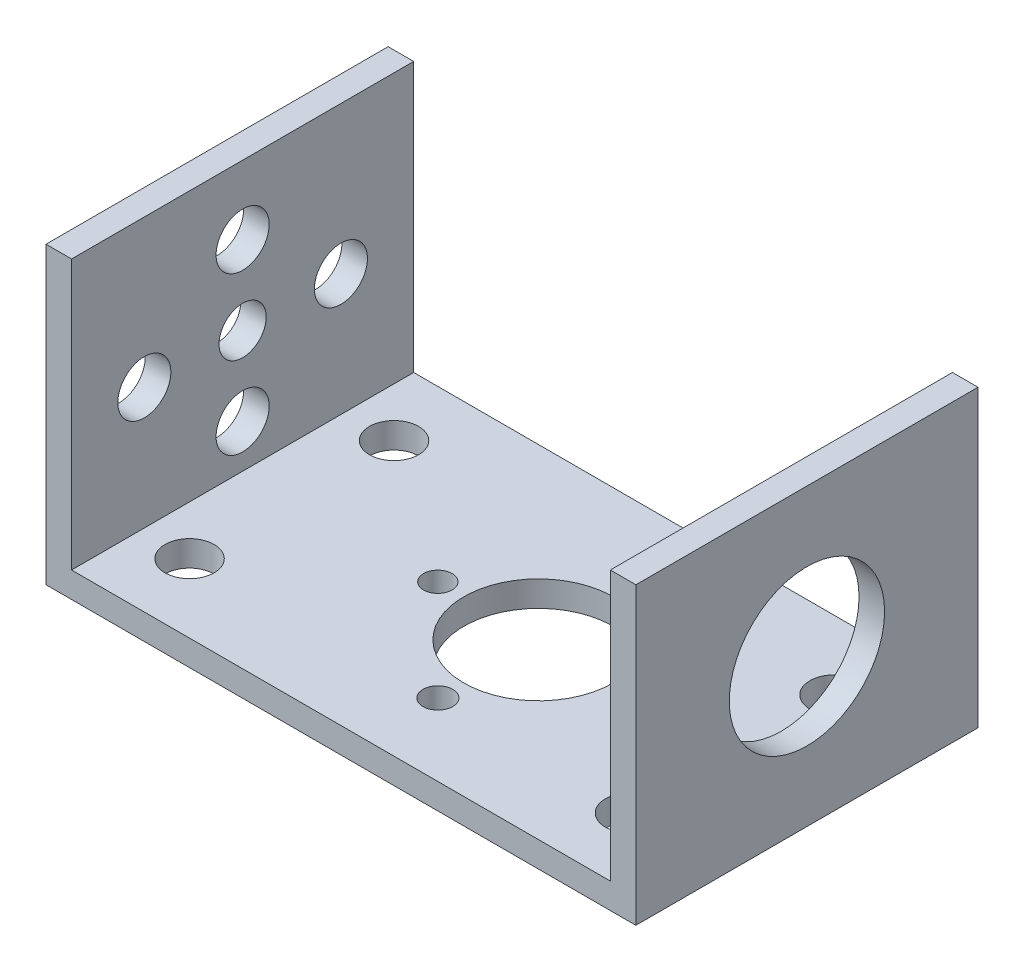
SolidWorks part; units mm, degrees
ref_plane "Front Plane" through (0, 0, 0) normal (0, 0, 1) x (1, 0, 0)
ref_plane "Top Plane" through (0, 0, 0) normal (0, 1, 0) x (1, 0, 0)
ref_plane "Right Plane" through (0, 0, 0) normal (1, 0, 0) x (0, 0, -1)
sketch "Sketch1" plane through (0, 0, 0) normal (0, 0, 1) x (1, 0, 0)
  line L0 (-37.366, 16.6368) -> (-37.366, -21.4632)
  line L1 (-37.366, -21.4632) -> (38.834, -21.4632)
  line L2 (38.834, -21.4632) -> (38.834, 16.6368)
  line L3 (-37.366, 16.6368) -> (-34.064, 16.6368)
  line L4 (-34.064, 16.6368) -> (-34.064, -18.1612)
  line L5 (-34.064, -18.1612) -> (35.532, -18.1612)
  line L6 (38.834, 16.6368) -> (35.532, 16.6368)
  line L7 (35.532, 16.6368) -> (35.532, -18.1612)
  dimension "D1" = 76.2
  dimension "D2" = 38.1
  dimension "D3" = 38.1
  dimension "D4" = 3.302
  dimension "D5" = 3.302
  dimension "D6" = 3.302
extrude "Boss-Extrude1" add sketch "Sketch1" along normal blind 44.196
sketch "Sketch3" plane through (0, -21.4632, 0) normal (0, -1, 0) x (1, 0, 0)
  line L0 (38.834, 22.098) -> (-37.366, 22.098) construction
  line L2 (38.834, 44.196) -> (38.834, 0) construction
  line L3 (-37.366, 44.196) -> (-37.366, 0) construction
  line L4 (3.909, 58.8828) -> (3.909, -15.1806) construction
  circle A0 centre (3.909, 21.8511) radius 9.65
  dimension "D2" = 19.3
  dimension "D1" = 41.275
extrude "Cut-Extrude4" cut sketch "Sketch3" against normal blind 60.452
sketch "Sketch4" plane through (-37.366, 0, 0) normal (-1, 0, 0) x (0, 0, 1)
  line L0 (22.098, 16.6368) -> (22.098, -23.0006) construction
  line L1 (44.196, 16.6368) -> (0, 16.6368) construction
  line L2 (44.196, -2.4132) -> (-3.7077, -2.4132) construction
  line L3 (44.196, 16.6368) -> (44.196, -21.4632) construction
  circle A0 centre (22.098, -2.4132) radius 3.048
  dimension "D1" = 6.096
extrude "Cut-Extrude6" cut sketch "Sketch4" against normal blind 8.128
sketch "Sketch5" plane through (38.834, 0, 0) normal (1, 0, 0) x (0, 0, -1)
  line L0 (-22.098, 16.6368) -> (-22.098, -22.7697) construction
  line L1 (-44.196, 16.6368) -> (0, 16.6368) construction
  line L2 (0, -2.4132) -> (-48.5431, -2.4132) construction
  line L3 (0, -21.4632) -> (0, 16.6368) construction
  circle A0 centre (-22.098, -2.4132) radius 10.033
  dimension "D1" = 20.066
extrude "Cut-Extrude7" cut sketch "Sketch5" against normal blind 16.002
sketch "Sketch6" plane through (-37.366, 0, 0) normal (-1, 0, 0) x (0, 0, 1)
  circle A0 centre (22.098, 7.7468) radius 3.429
  circle A1 centre (34.798, -2.4132) radius 3.429
  circle A2 centre (22.098, -12.5732) radius 3.429
  circle A3 centre (9.398, -2.4132) radius 3.429
  circle A4 centre (22.098, -2.4132) radius 3.048 construction
  dimension "D1" = 12.7
  dimension "D3" = 6.858
  dimension "D4" = 6.858
  dimension "D5" = 6.858
  dimension "D6" = 6.858
  dimension "D8" = 10.16
  dimension "D2" = 12.7
  dimension "D7" = 10.16
extrude "Cut-Extrude8" cut sketch "Sketch6" against normal blind 16.002
sketch "Sketch7" plane through (0, -18.1612, 0) normal (0, 1, 0) x (1, 0, 0)
  line L0 (35.532, 0) -> (-34.064, 0) construction
  line L1 (35.532, -44.196) -> (-34.064, -44.196) construction
  line L2 (-34.064, -44.196) -> (-34.064, 0) construction
  line L3 (35.532, -44.196) -> (35.532, 0) construction
  line L4 (35.532, -44.196) -> (35.532, 0) construction
  circle A0 centre (29.182, -8.89) radius 3.175
  circle A1 centre (29.182, -35.306) radius 3.175
  circle A2 centre (-27.714, -8.89) radius 3.175
  circle A3 centre (-27.714, -35.306) radius 3.175
  dimension "D1" = 6.35
  dimension "D2" = 6.35
  dimension "D3" = 6.35
  dimension "D4" = 6.35
  dimension "D5" = 8.89
  dimension "D6" = 8.89
  dimension "D7" = 8.89
  dimension "D8" = 8.89
  dimension "D9" = 6.35
  dimension "D10" = 6.35
  dimension "D11" = 6.35
  dimension "D12" = 6.35
extrude "Cut-Extrude9" cut sketch "Sketch7" against normal blind 16.002
sketch "Sketch8" plane through (0, -21.4632, 0) normal (0, -1, 0) x (1, 0, 0)
  circle A0 centre (-9.091, 21.8511) radius 1.8446
  circle A1 centre (3.909, 34.8511) radius 1.926
  circle A2 centre (16.909, 21.8511) radius 1.799
  circle A3 centre (3.909, 8.8511) radius 1.6525
  circle A4 centre (3.909, 21.8511) radius 9.65 construction
  dimension "D2" = 13
  dimension "D4" = 13
  dimension "D1" = 13
  dimension "D3" = 13
extrude "Cut-Extrude10" cut sketch "Sketch8" against normal blind 10
